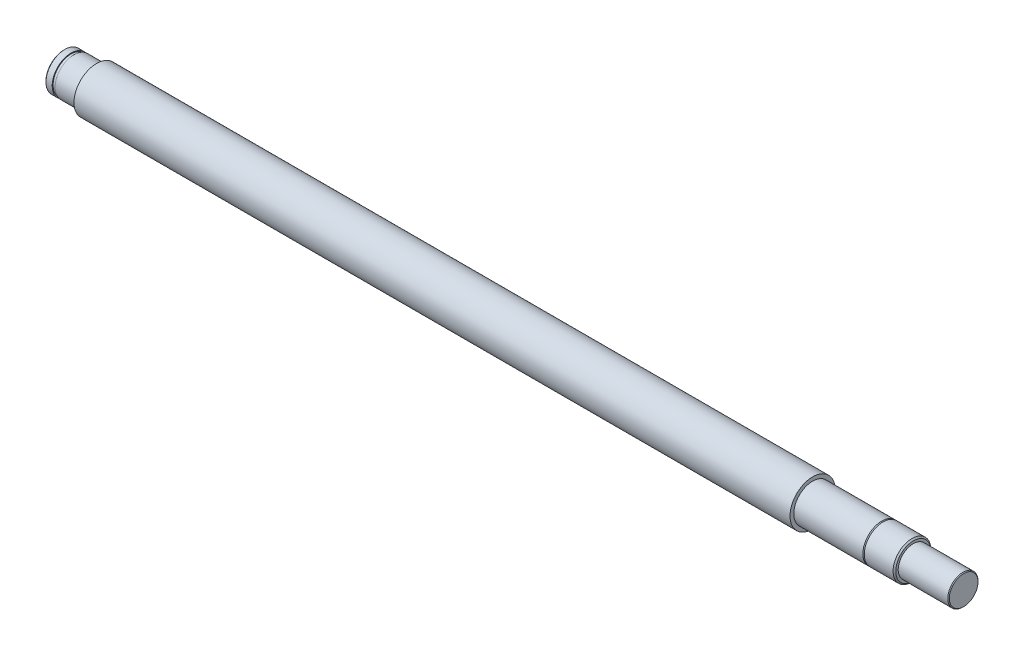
SolidWorks part; units mm, degrees
ref_plane "Plan de face" through (0, 0, 0) normal (0, 0, 1) x (1, 0, 0)
ref_plane "Plan de dessus" through (0, 0, 0) normal (0, 1, 0) x (1, 0, 0)
ref_plane "Plan de droite" through (0, 0, 0) normal (1, 0, 0) x (0, 0, -1)
sketch "Esquisse1" plane through (0, 0, 0) normal (0, 0, 1) x (1, 0, 0)
  line L0 (-70.5, 7.125) -> (-70.5, 0)
  line L1 (-70.5, 0) -> (287, 0)
  line L2 (287, 0) -> (287, 5.7)
  line L3 (287, 5.7) -> (286.7, 6)
  line L4 (286.7, 6) -> (267, 6)
  line L5 (267, 6) -> (267, 6.9587)
  line L6 (267, 6.9587) -> (266.4588, 7.5)
  line L7 (266.4588, 7.5) -> (255, 7.5)
  line L8 (255, 7.5) -> (255, 6.9588)
  line L9 (255, 6.9588) -> (254.4588, 7.5)
  line L10 (254.4588, 7.5) -> (227, 7.5)
  line L11 (227, 7.5) -> (227, 9)
  line L12 (227, 9) -> (-57.5, 9)
  line L13 (-57.5, 9) -> (-57.5, 7.5)
  line L14 (-57.5, 7.5) -> (-66.5, 7.5)
  line L15 (-66.5, 7.5) -> (-66.5, 7.15)
  line L16 (-66.5, 7.15) -> (-67.65, 7.15)
  line L17 (-67.65, 7.15) -> (-67.65, 7.5)
  line L18 (-67.65, 7.5) -> (-70.125, 7.5)
  line L19 (-70.125, 7.5) -> (-70.5, 7.125)
  line L20 (-70.5, 0) -> (287, 0) construction
  line L21 (-70.5, 0) -> (-23.2095, 0) construction
  dimension "D1" = 45
  dimension "D2" = 14.3
  dimension "D3" = 1.15
  dimension "D4" = 9
  dimension "D5" = 13
  dimension "D6" = 0.375
  dimension "D7" = 357.5
  dimension "D8" = 18
revolve "Révolution1" add sketch "Esquisse1" angle 360 about L20
